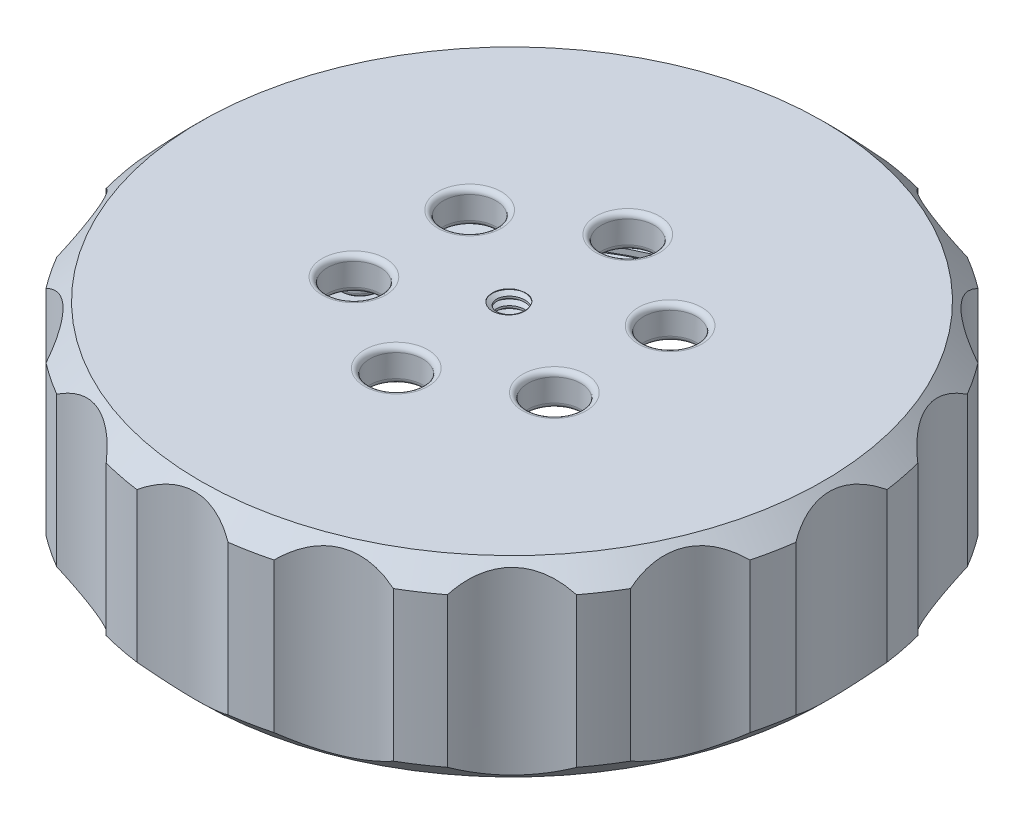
SolidWorks part; units mm, degrees
ref_plane "Front Plane" through (0, 0, 0) normal (0, 0, 1) x (1, 0, 0)
ref_plane "Top Plane" through (0, 0, 0) normal (0, 1, 0) x (1, 0, 0)
ref_plane "Right Plane" through (0, 0, 0) normal (1, 0, 0) x (0, 0, -1)
sketch "Sketch1" plane through (0, 0, 0) normal (0, 1, 0) x (1, 0, 0)
  circle A0 centre (0, 0) radius 31.9405
  dimension "D1" = 63.881
extrude "base" add sketch "Sketch1" along normal blind 18.415
sketch "Sketch21" plane through (0, 0, 0) normal (0, -1, 0) x (1, 0, 0)
  circle A0 centre (0, 0) radius 27.5463
  dimension "D1" = 55.0926
extrude "thread bore" cut sketch "Sketch21" against normal blind 15.24
thread "Thread1" pitch 2.1167 start angle 0, offset 5.08, length 0, pitch 2.1167, diameter 55.0926
ref_plane "Plane1" through (27.5463, -5.08, 0) normal (0, 0, 1) x (1, 0, 0)
sketch "Thread Profile1" plane through (27.5463, -5.08, 0) normal (0, 0, 1) x (1, 0, 0)
  line L0 (0, 0) -> (0, 2.1167) construction
  line L1 (0, 0) -> (1.1457, 0.6615)
  line L2 (1.1457, 0.6615) -> (1.1457, 0.926)
  line L3 (1.1457, 0.926) -> (0, 1.5875)
  line L4 (1.1457, 0.7937) -> (0, 0.7937) construction
  line L11 (0, 0) -> (0, 1.5875)
  point P2 (0, 0)
  dimension "Pitch" = 2.1167
  dimension "Profile_Angle" = 60
  dimension "Profile_Land" = 0.2646
  dimension "Profile_Height" = 1.1457
sketch "Sketch36" plane through (0, 0, 0) normal (0, 0, 1) x (1, 0, 0)
  line L0 (0, 0) -> (0, 25.3675) construction
  line L1 (-22.2854, 15.24) -> (16.1913, 15.24) construction
  line L2 (0, 15.24) -> (28.956, 15.24)
  line L3 (0, 15.24) -> (0, 10.16)
  line L4 (0, 10.16) -> (28.956, 10.16)
  line L5 (29.464, 14.732) -> (29.464, 10.668)
  arc A0 (28.956, 10.16) -> (29.464, 10.668) centre (28.956, 10.668) ccw
  arc A1 (28.956, 15.24) -> (29.464, 14.732) centre (28.956, 14.732) cw
  point P11 (29.464, 10.16)
  point P14 (29.464, 15.24)
  dimension "D3" = 0.508
  dimension "D1" = 5.08
  dimension "D2" = 58.928
revolve "thread relif" cut sketch "Sketch36" angle 360 about L0
sketch "Sketch22" plane through (0, 15.24, 0) normal (0, -1, 0) x (1, 0, 0)
  circle A0 centre (0, 0) radius 6.985
  dimension "D1" = 13.97
extrude "spring bore" cut sketch "Sketch22" against normal blind 0.762
sketch "Sketch31" plane through (0, 18.415, 0) normal (0, 1, 0) x (1, 0, 0)
  line L0 (0, 0) -> (0, 22.225) construction
  line L1 (0, 0) -> (9.6237, 5.5562) construction
  line L2 (0, 0) -> (9.6237, -5.5563) construction
  circle A0 centre (0, 0) radius 11.1125 construction
  circle A1 centre (0, 11.1125) radius 2.54
  circle A2 centre (9.6237, 5.5562) radius 2.54
  circle A3 centre (9.6237, -5.5563) radius 2.54
  circle A4 centre (0, -11.1125) radius 2.54
  circle A5 centre (-9.6237, -5.5563) radius 2.54
  circle A6 centre (-9.6237, 5.5562) radius 2.54
  dimension "D1" = 22.225
  dimension "D2" = 5.08
  dimension "D4" = 60
  dimension "D5" = 60
  dimension "D3" = 6
extrude "vent holes" cut sketch "Sketch31" against normal through all
sketch "Sketch32" plane through (0, 15.24, 0) normal (0, -1, 0) x (1, 0, 0)
  line L0 (0, 0) -> (52.9937, 0) construction
  line L1 (0, 0) -> (7.3025, -12.6483) construction
  line L2 (0, 0) -> (-7.3025, -12.6483) construction
  circle A0 centre (14.605, 0) radius 1.905
  circle A1 centre (7.3025, 12.6483) radius 1.905
  circle A2 centre (-7.3025, 12.6483) radius 1.905
  circle A3 centre (-14.605, 0) radius 1.905
  circle A4 centre (-7.3025, -12.6483) radius 1.905
  circle A5 centre (7.3025, -12.6483) radius 1.905
  dimension "D1" = 3.81
  dimension "D2" = 14.605
  dimension "D4" = 60
  dimension "D5" = 60
  dimension "D3" = 6
extrude "piston stops" add sketch "Sketch32" along normal blind 2.54
chamfer "Chamfer1" distance 2.032 angle 45 2 edges at (0, 0, 31.9405) (0, 18.415, 31.9405)
fillet "Fillet1" radius 0.508 12 edges at (0, 18.415, 13.6525) (0, 15.24, 8.5725) (9.6237, 18.415, 8.0963) (9.6237, 15.24, 3.0163) (9.6237, 18.415, -3.0162) (9.6237, 15.24, -8.0962) (0, 18.415, -8.5725) (0, 15.24, -13.6525) (-9.6237, 18.415, 8.0963) (-9.6237, 15.24, 3.0163) (-9.6237, 18.415, -3.0162) (-9.6237, 15.24, -8.0962)
sketch "Sketch37" plane through (0, 18.415, 0) normal (0, 1, 0) x (1, 0, 0)
  line L0 (0, 0) -> (0, 40.7768) construction
  arc A0 (-4.3869, 31.6378) -> (4.3869, 31.6378) centre (0, 39.37) ccw
  circle A1 centre (0, 0) radius 31.9405 construction
  arc A2 (4.3869, 31.6378) -> (-4.3869, 31.6378) centre (0, 0) ccw
  arc A3 (8.0543, 30.9083) -> (16.1603, 27.5507) centre (15.0662, 36.3731) ccw
  arc A4 (16.1603, 27.5507) -> (8.0543, 30.9083) centre (0, 0) ccw
  arc A5 (19.2693, 25.4733) -> (25.4733, 19.2693) centre (27.8388, 27.8388) ccw
  arc A6 (25.4733, 19.2693) -> (19.2693, 25.4733) centre (0, 0) ccw
  arc A7 (27.5507, 16.1603) -> (30.9083, 8.0543) centre (36.3731, 15.0662) ccw
  arc A8 (30.9083, 8.0543) -> (27.5507, 16.1603) centre (0, 0) ccw
  arc A9 (31.6378, 4.3869) -> (31.6378, -4.3869) centre (39.37, 0) ccw
  arc A10 (31.6378, -4.3869) -> (31.6378, 4.3869) centre (0, 0) ccw
  arc A11 (30.9083, -8.0543) -> (27.5507, -16.1603) centre (36.3731, -15.0662) ccw
  arc A12 (27.5507, -16.1603) -> (30.9083, -8.0543) centre (0, 0) ccw
  arc A13 (25.4733, -19.2693) -> (19.2693, -25.4733) centre (27.8388, -27.8388) ccw
  arc A14 (19.2693, -25.4733) -> (25.4733, -19.2693) centre (0, 0) ccw
  arc A15 (16.1603, -27.5507) -> (8.0543, -30.9083) centre (15.0662, -36.3731) ccw
  arc A16 (8.0543, -30.9083) -> (16.1603, -27.5507) centre (0, 0) ccw
  arc A17 (4.3869, -31.6378) -> (-4.3869, -31.6378) centre (0, -39.37) ccw
  arc A18 (-4.3869, -31.6378) -> (4.3869, -31.6378) centre (0, 0) ccw
  arc A19 (-8.0543, -30.9083) -> (-16.1603, -27.5507) centre (-15.0662, -36.3731) ccw
  arc A20 (-16.1603, -27.5507) -> (-8.0543, -30.9083) centre (0, 0) ccw
  arc A21 (-19.2693, -25.4733) -> (-25.4733, -19.2693) centre (-27.8388, -27.8388) ccw
  arc A22 (-25.4733, -19.2693) -> (-19.2693, -25.4733) centre (0, 0) ccw
  arc A23 (-27.5507, -16.1603) -> (-30.9083, -8.0543) centre (-36.3731, -15.0662) ccw
  arc A24 (-30.9083, -8.0543) -> (-27.5507, -16.1603) centre (0, 0) ccw
  arc A25 (-31.6378, -4.3869) -> (-31.6378, 4.3869) centre (-39.37, 0) ccw
  arc A26 (-31.6378, 4.3869) -> (-31.6378, -4.3869) centre (0, 0) ccw
  arc A27 (-30.9083, 8.0543) -> (-27.5507, 16.1603) centre (-36.3731, 15.0662) ccw
  arc A28 (-27.5507, 16.1603) -> (-30.9083, 8.0543) centre (0, 0) ccw
  arc A29 (-25.4733, 19.2693) -> (-19.2693, 25.4733) centre (-27.8388, 27.8388) ccw
  arc A30 (-19.2693, 25.4733) -> (-25.4733, 19.2693) centre (0, 0) ccw
  arc A31 (-16.1603, 27.5507) -> (-8.0543, 30.9083) centre (-15.0662, 36.3731) ccw
  arc A32 (-8.0543, 30.9083) -> (-16.1603, 27.5507) centre (0, 0) ccw
  dimension "D1" = 17.78
  dimension "D2" = 39.37
  dimension "D3" = 16
extrude "outside flutes" cut sketch "Sketch37" against normal through all
fillet "Fillet2" radius 0.381 14 edges at (0, 16.002, -6.985) (0, 15.24, -6.985) (-7.3025, 12.7, 10.7433) (-7.3025, 15.24, 10.7433) (7.3025, 12.7, 10.7433) (7.3025, 15.24, 10.7433) (14.605, 12.7, -1.905) (14.605, 15.24, -1.905) (7.3025, 12.7, -14.5533) (7.3025, 15.24, -14.5533) (-7.3025, 12.7, -14.5533) (-7.3025, 15.24, -14.5533) (-14.605, 12.7, -1.905) (-14.605, 15.24, -1.905)
sketch "Sketch38" plane through (0, 18.415, 0) normal (0, 1, 0) x (1, 0, 0)
  point P0 (0, 0)
hole_wizard "#6-32 Tapped Hole1" positions "Sketch38" profile "Sketch39" tap size "#6-32" standard "ANSI Inch"
sketch "Sketch39" plane through (0, 18.415, 0) normal (1, 0, 0) x (0, 0, 1)
  line L0 (0, 0) -> (0, 10.2107)
  line L1 (0, 10.2107) -> (1.3525, 9.398)
  line L2 (1.3525, 9.398) -> (1.3525, 0)
  line L5 (1.3525, 0) -> (0, 0)
  line L10 (0, 10.2107) -> (-1.3525, 9.398) construction
  line L11 (0, -6.35) -> (0, 107.95) construction
  dimension "Tap Drill Dia." = 2.7051
  dimension "Tap Drill Depth" = 9.398
  dimension "Drill Angle" = 118
thread "Thread2" pitch 0.7937 start angle 0, offset 2.54, length 0, pitch 0.7937, diameter 2.7051
ref_plane "Plane2" through (-1.3525, 20.955, 0) normal (0, 0, 1) x (-1, 0, 0)
sketch "Thread Profile2" plane through (-1.3525, 20.955, 0) normal (0, 0, 1) x (-1, 0, 0)
  line L0 (0, 0) -> (0, 0.7937) construction
  line L1 (0, 0) -> (0.4296, 0.248)
  line L2 (0.4296, 0.248) -> (0.4296, 0.3473)
  line L3 (0.4296, 0.3473) -> (0, 0.5953)
  line L4 (0.4296, 0.2977) -> (0, 0.2977) construction
  line L11 (0, 0) -> (0, 0.5953)
  point P2 (0, 0)
  dimension "Pitch" = 0.7937
  dimension "Profile_Angle" = 60
  dimension "Profile_Land" = 0.0992
  dimension "Profile_Height" = 0.4296
